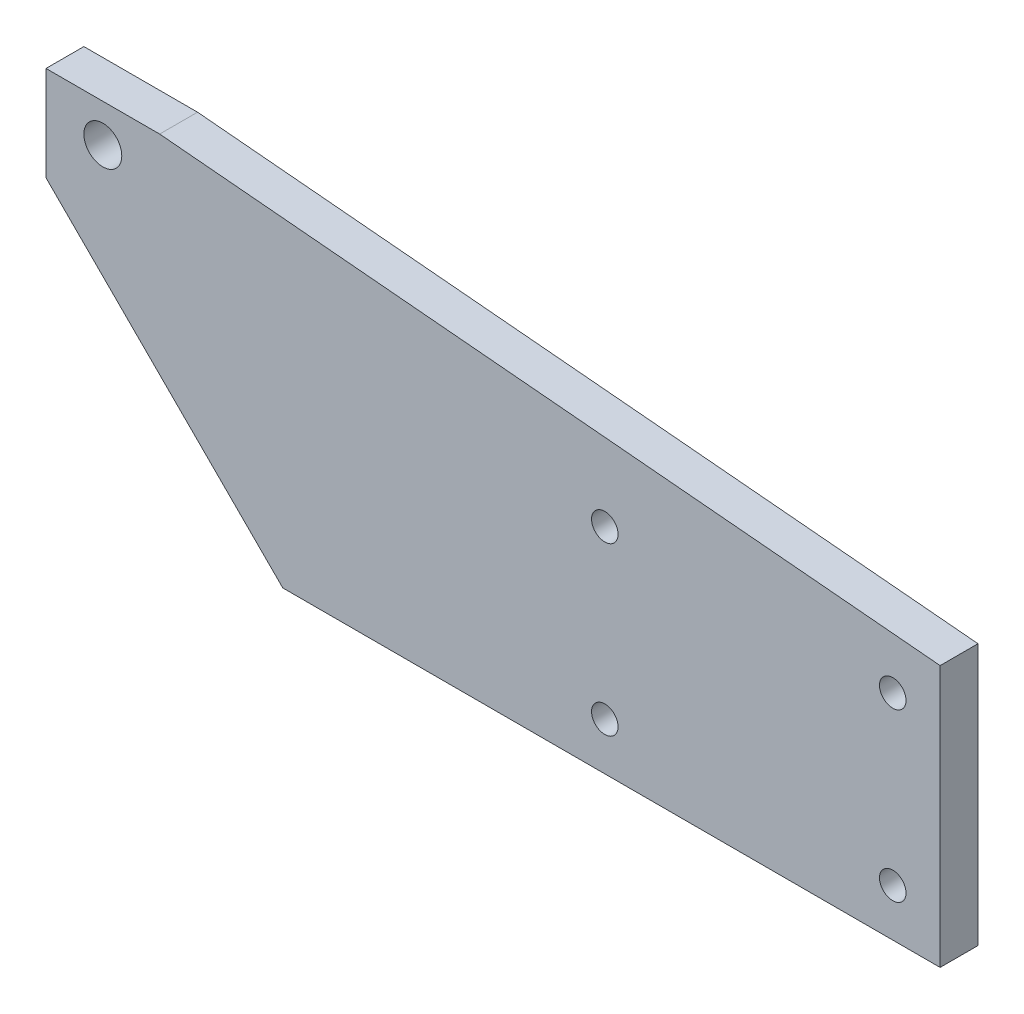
SolidWorks part; units mm, degrees
ref_plane "Front" through (0, 0, 0) normal (0, 0, 1) x (1, 0, 0)
ref_plane "Top" through (0, 0, 0) normal (0, 1, 0) x (1, 0, 0)
ref_plane "Right" through (0, 0, 0) normal (1, 0, 0) x (0, 0, -1)
sketch "Esquisse1" plane through (0, 0, 0) normal (0, 0, 1) x (1, 0, 0)
  line L0 (0, 125) -> (0, 175)
  line L1 (0, 175) -> (60, 175)
  line L2 (125, 0) -> (472, 0)
  line L3 (472, 0) -> (472, 138)
  line L4 (472, 138) -> (60, 175)
  line L5 (125, 0) -> (0, 125)
  circle A0 centre (30, 155) radius 10
  circle A1 centre (447, 25) radius 7
  circle A2 centre (447, 113) radius 7
  circle A3 centre (295, 25) radius 7
  circle A4 centre (295, 113) radius 7
  point P0 (0, 0)
  dimension "D7" = 20
  dimension "D10" = 14
  dimension "D13" = 14
  dimension "D14" = 14
  dimension "D15" = 14
  dimension "D1" = 472
  dimension "D2" = 138
  dimension "D3" = 175
  dimension "D4" = 60
  dimension "D5" = 125
  dimension "D6" = 45
  dimension "D8" = 20
  dimension "D9" = 30
  dimension "D11" = 25
  dimension "D12" = 25
  dimension "D16" = 177
  dimension "D17" = 152
  dimension "D18" = 177
  dimension "D19" = 152
  dimension "D20" = 88
  dimension "D21" = 88
extrude "Base-Extrusion" add sketch "Esquisse1" along normal blind 20
